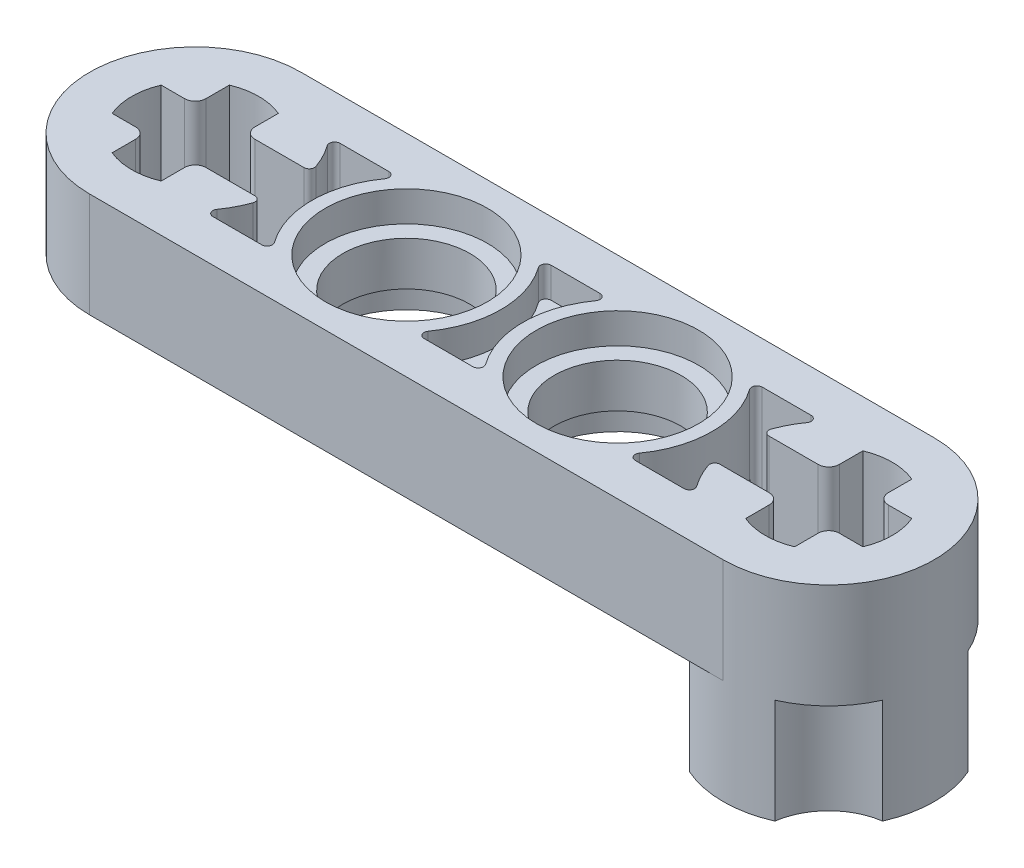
SolidWorks part; units mm, degrees
ref_plane "Front" through (0, 0, 0) normal (0, 0, 1) x (1, 0, 0)
ref_plane "Top" through (0, 0, 0) normal (0, 1, 0) x (1, 0, 0)
ref_plane "Right" through (0, 0, 0) normal (1, 0, 0) x (0, 0, -1)
sketch "Sketch1" plane through (0, 0, 0) normal (0, 1, 0) x (1, 0, 0)
  line L0 (0, 0) -> (0, 8.6394) construction
  line L1 (-11.9063, 3.9687) -> (11.9063, 3.9687)
  line L2 (11.9063, -3.9687) -> (-11.9063, -3.9687)
  line L3 (0, 0) -> (18.7139, 0) construction
  arc A0 (11.9063, 3.9687) -> (11.9063, -3.9687) centre (11.9063, 0) cw
  arc A1 (-11.9063, 3.9687) -> (-11.9063, -3.9687) centre (-11.9063, 0) ccw
  point P6 (0, 3.9687)
  point P11 (0, -3.9688)
  dimension "D1" = 7.9375
  dimension "D2" = 31.75
extrude "Base-Extrude" add sketch "Sketch1" along normal mid plane 3.937
sketch "Sketch2" plane through (0, 1.9685, 0) normal (0, 1, 0) x (-1, 0, 0)
  circle A0 centre (3.9688, 0) radius 2.3876
  dimension "D1" = 4.7752
  dimension "D2" = 3.9688
extrude "Cut-Extrude1" cut sketch "Sketch2" against normal through all
sketch "Sketch3" plane through (0, 1.9685, 0) normal (0, 1, 0) x (-1, 0, 0)
  circle A0 centre (3.9688, 0) radius 3.048
  dimension "D1" = 6.096
extrude "Cut-Extrude2" cut sketch "Sketch3" against normal blind 1.143
sketch "Sketch4" plane through (0, -1.9685, 0) normal (0, -1, 0) x (1, 0, 0)
  circle A0 centre (-3.9688, 0) radius 3.048
  dimension "D1" = 6.096
extrude "Cut-Extrude3" cut sketch "Sketch4" against normal blind 1.143
pattern_linear "LPattern1" count 2 spacing 7.9375 along (1, 0, 0) of "Cut-Extrude3", "Cut-Extrude2", "Cut-Extrude1"
sketch "Sketch5" plane through (0, 1.9685, 0) normal (0, 1, 0) x (-1, 0, 0)
  line L0 (11.9063, 0) -> (11.9063, -5.3472) construction
  line L1 (11.9063, 0) -> (8.2567, 0) construction
  line L2 (10.9855, -2.2029) -> (10.9855, -0.9207)
  line L3 (10.9855, -0.9207) -> (9.7033, -0.9207)
  line L4 (10.9855, 0.9208) -> (9.7033, 0.9208)
  line L5 (10.9855, 2.2029) -> (10.9855, 0.9208)
  line L6 (12.827, 2.2029) -> (12.827, 0.9208)
  line L7 (12.827, 0.9208) -> (14.1092, 0.9208)
  line L8 (12.827, -0.9207) -> (14.1092, -0.9207)
  line L9 (12.827, -2.2029) -> (12.827, -0.9207)
  arc A0 (10.9855, -2.2029) -> (12.827, -2.2029) centre (11.9063, 0) ccw
  arc A1 (9.7033, 0.9208) -> (9.7033, -0.9207) centre (11.9063, 0) ccw
  arc A2 (12.827, 2.2029) -> (10.9855, 2.2029) centre (11.9063, 0) ccw
  arc A3 (14.1092, -0.9207) -> (14.1092, 0.9208) centre (11.9063, 0) ccw
  dimension "D1" = 4.7752
  dimension "D2" = 0.9207
extrude "Cut-Extrude4" cut sketch "Sketch5" against normal through all
fillet "Fillet1" radius 0.3969 4 edges at (-12.827, 0, -0.9207) (-10.9855, 0, -0.9207) (-12.827, 0, 0.9208) (-10.9855, 0, 0.9208)
sketch "Sketch6" plane through (0, 1.9685, 0) normal (0, 1, 0) x (-1, 0, 0)
  line L0 (9.271, -2.3876) -> (6.604, -2.3876)
  line L1 (11.9063, 0) -> (3.9688, 0) construction
  line L2 (9.271, 2.3876) -> (6.604, 2.3876)
  line L3 (9.7033, -0.9207) -> (8.4715, -0.9207)
  line L4 (9.7033, 0.9208) -> (8.4715, 0.9208)
  circle A0 centre (3.9688, 0) radius 2.3876 construction
  arc A2 (6.604, -2.3876) -> (6.604, 2.3876) centre (3.9688, 0) ccw
  arc A3 (9.271, 2.3876) -> (8.4715, 0.9208) centre (11.9063, 0) ccw
  arc A4 (9.7033, 0.9208) -> (9.7033, -0.9207) centre (11.9063, 0) ccw construction
  arc A5 (9.7033, 0.9208) -> (9.7033, -0.9207) centre (11.9063, 0) ccw
  arc A6 (8.4715, -0.9207) -> (9.271, -2.3876) centre (11.9063, 0) ccw
  dimension "D2" = 7.112
extrude "Cut-Extrude5" cut sketch "Sketch6" against normal through all
fillet "Fillet2" radius 0.1984 6 edges at (-8.4715, 0, -0.9207) (-9.271, 0, -2.3876) (-6.604, 0, -2.3876) (-6.604, 0, 2.3876) (-9.271, 0, 2.3876) (-8.4715, 0, 0.9208)
mirror "Mirror1" about plane through (0, 0, 0) normal (1, 0, 0) of "Fillet2", "Cut-Extrude5", "Fillet1", "Cut-Extrude4"
sketch "Sketch7" plane through (7.6266, 1.9685, -1.7506) normal (0, 1, 0) x (-1, 0, 0)
  line L0 (8.9601, -0.637) -> (6.2931, -0.637)
  line L1 (11.5954, 1.7506) -> (3.6579, 1.7506) construction
  line L2 (8.9601, 4.1382) -> (6.2931, 4.1382)
  circle A0 centre (11.5954, 1.7506) radius 2.3876 construction
  circle A1 centre (3.6579, 1.7506) radius 2.3876 construction
  arc A2 (6.2931, -0.637) -> (6.2931, 4.1382) centre (3.6579, 1.7506) ccw
  arc A3 (8.9601, 4.1382) -> (8.0394, 1.7506) centre (11.5954, 1.7506) ccw
  arc A6 (8.0394, 1.7506) -> (8.9601, -0.637) centre (11.5954, 1.7506) ccw
  dimension "D2" = 7.112
extrude "Cut-Extrude6" cut sketch "Sketch7" against normal blind 1.143
fillet "Fillet3" radius 0.1984 4 edges at (-1.3335, 1.397, -2.3876) (1.3335, 1.397, -2.3876) (1.3335, 1.397, 2.3876) (-1.3335, 1.397, 2.3876)
mirror "Mirror2" about plane through (0, 0, 0) normal (0, 1, 0) of "Fillet3", "Cut-Extrude6"
sketch "Sketch8" plane through (0, -1.9685, 0) normal (0, -1, 0) x (1, 0, 0)
  circle A0 centre (11.9063, 0) radius 3.9687
  circle A1 centre (11.9063, 0) radius 2.3876
extrude "Boss-Extrude1" add sketch "Sketch8" along normal blind 3.937
sketch "Sketch9" plane through (0, -5.9055, 0) normal (0, -1, 0) x (1, 0, 0)
  line L0 (11.9063, 0) -> (11.9063, -4.7829) construction
  line L1 (11.9063, 0) -> (15.8424, -3.9361) construction
  circle A0 centre (15.875, -3.9687) radius 2.3876
  dimension "D2" = 4.7752
  dimension "D1" = 45
  dimension "D3" = 3.9688
extrude "Cut-Extrude7" cut sketch "Sketch9" against normal up to surface (3.937 mm away)
pattern_circular "CirPattern1" count 4 every 90 about axis through (11.9063, 0, 0) along (0, 1, 0) of "Cut-Extrude7"
